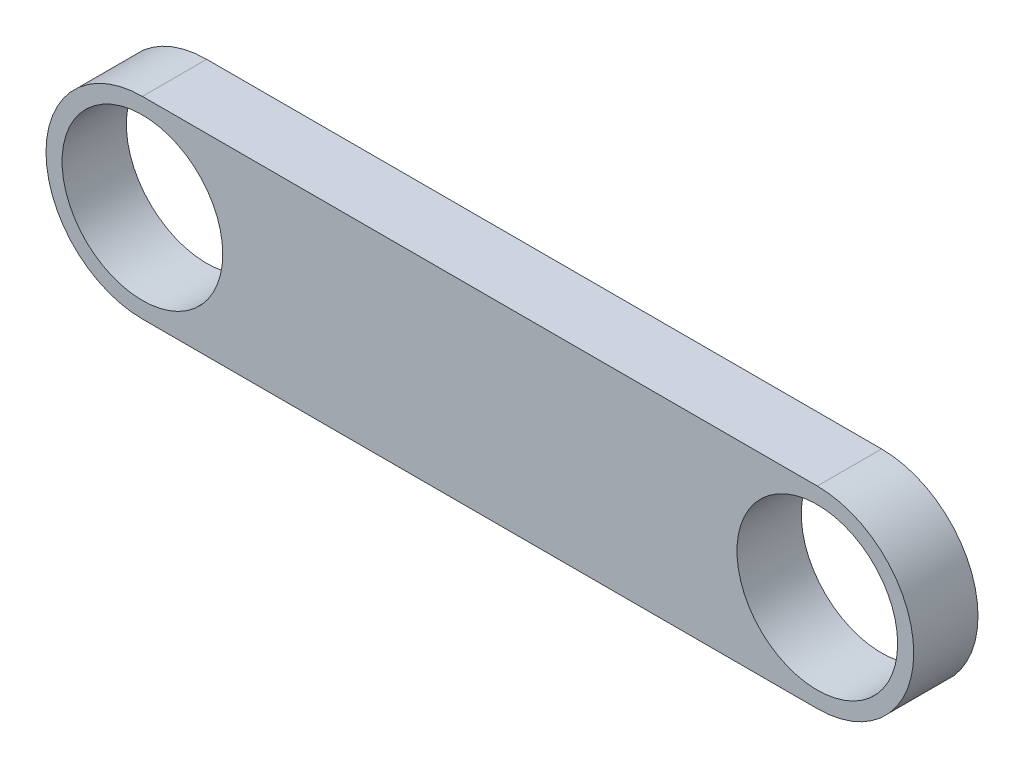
SolidWorks part; units mm, degrees
ref_plane "Front Plane" through (0, 0, 0) normal (0, 0, 1) x (1, 0, 0)
ref_plane "Top Plane" through (0, 0, 0) normal (0, 1, 0) x (1, 0, 0)
ref_plane "Right Plane" through (0, 0, 0) normal (1, 0, 0) x (0, 0, -1)
sketch "Sketch1" plane through (0, 0, 0) normal (0, 0, 1) x (1, 0, 0)
  line L0 (0, 0) -> (105, 0) construction
  line L1 (0, 15) -> (105, 15)
  line L2 (0, -15) -> (105, -15)
  arc A0 (0, 15) -> (0, -15) centre (0, 0) ccw
  arc A1 (105, -15) -> (105, 15) centre (105, 0) ccw
  circle A2 centre (0, 0) radius 12.5
  circle A3 centre (105, 0) radius 12.5
  point P3 (52.5, 0)
  dimension "D1" = 15
  dimension "D3" = 25
  dimension "D4" = 25
  dimension "D2" = 105
extrude "Boss-Extrude1" add sketch "Sketch1" along normal blind 10
